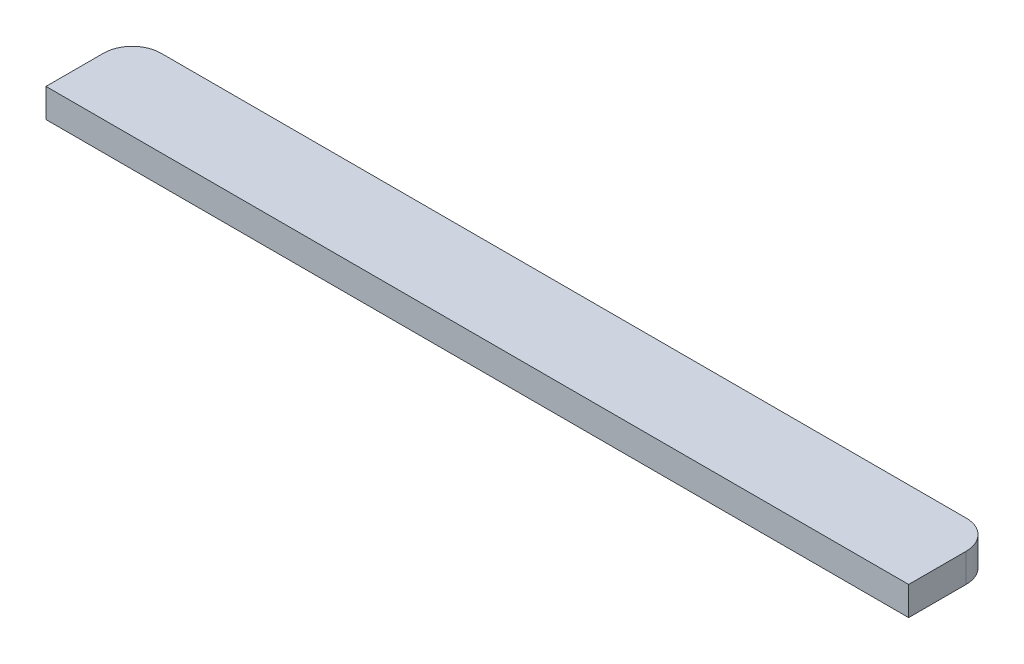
SolidWorks part; units mm, degrees
ref_plane "Front" through (0, 0, 0) normal (0, 0, 1) x (1, 0, 0)
ref_plane "Top" through (0, 0, 0) normal (0, 1, 0) x (1, 0, 0)
ref_plane "Right" through (0, 0, 0) normal (1, 0, 0) x (0, 0, -1)
sketch "Sketch2" plane through (0, 0, 0) normal (0, 0, -1) x (-1, 0, 0)
  line L1 (0, 0) -> (190.5, 0)
  line L2 (0, 0) -> (0, 6.35)
  line L3 (0, 6.35) -> (190.5, 6.35)
  line L4 (190.5, 0) -> (190.5, 6.35)
  dimension "D1" = 190.5
  dimension "D2" = 6.35
extrude "Extrude2" add sketch "Sketch2" along normal blind 19.05 separate body
fillet "Fillet1" radius 6.35 2 edges at (0, 3.175, -19.05) (-190.5, 3.175, -19.05)
